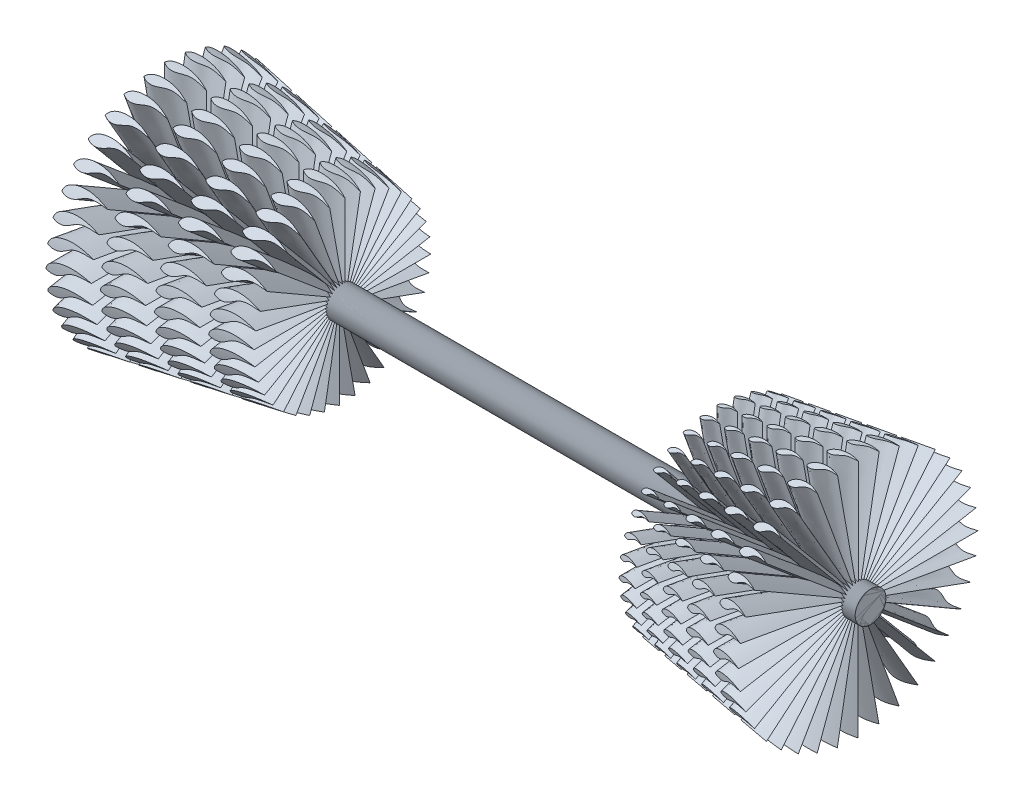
SolidWorks part; units mm, degrees
ref_plane "Front Plane" through (0, 0, 0) normal (0, 0, 1) x (1, 0, 0)
ref_plane "Top Plane" through (0, 0, 0) normal (0, 1, 0) x (1, 0, 0)
ref_plane "Right Plane" through (0, 0, 0) normal (1, 0, 0) x (0, 0, -1)
sketch "Sketch1" plane through (0, 0, 0) normal (0, 0, 1) x (1, 0, 0)
  line L0 (-8409.0038, 0) -> (412041.1874, 0) construction
  line L1 (-825.2751, 0) -> (-825.2751, -600.71) construction
  line L2 (-825.2751, -600.71) -> (-647.4751, -508) construction
  line L3 (-647.4751, -508) -> (1105.1249, -279.4) construction
  line L4 (1105.1249, -279.4) -> (2629.1249, -508) construction
  line L5 (2629.1249, -508) -> (3264.1249, -406.4) construction
  line L6 (3264.1249, -406.4) -> (3264.1249, 0) construction
  line L11 (-647.4751, -1000) -> (-647.4751, 49000) construction
  line L12 (-139.4751, -974.1318) -> (-139.4751, 49025.8682) construction
  line L13 (2451.3249, -1000) -> (2451.3249, 49000) construction
  line L14 (1816.3249, -978.7031) -> (1816.3249, 49021.2969) construction
  line L15 (-418.8751, -909.4028) -> (-418.8751, 49090.5972) construction
  line L17 (-291.8751, 0) -> (-291.8751, -63.5)
  line L18 (-291.8751, -63.5) -> (2451.3249, -63.5)
  line L19 (-291.8751, 0) -> (2451.3249, 0)
  line L20 (2552.9249, -1117.9768) -> (2552.9249, 48882.0232) construction
  line L21 (2451.3249, 0) -> (2552.9249, 0)
  line L23 (2552.9249, -63.5) -> (2451.3249, -63.5)
  line L24 (2552.9249, 0) -> (2679.8259, 0)
  line L25 (2679.8259, 0) -> (2679.8259, -63.5)
  line L26 (2679.8259, -63.5) -> (2552.9249, -63.5)
  dimension "D1" = 600.71
  dimension "D2" = 177.8
  dimension "D3" = 1752.6
  dimension "D4" = 1524
  dimension "D5" = 279.4
  dimension "D6" = 508
  dimension "D7" = 508
  dimension "D8" = 406.4
  dimension "D9" = 4089.4
  dimension "D10" = 2743.2
  dimension "D11" = 63.5
  dimension "D12" = 177.8
  dimension "D13" = 508
  dimension "D14" = 635
  dimension "D15" = 406.4
  dimension "D16" = 63.5
  dimension "D17" = 101.6
revolve "Revolve1" add sketch "Sketch1" angle 360 about L0
ref_plane "Plane1" through (0, -508, 0) normal (0, 1, 0) x (1, 0, 0)
sketch "Sketch2" plane through (0, -508, 0) normal (0, 1, 0) x (1, 0, 0)
  line L0 (2292.8763, -990.2749) -> (2292.8763, 49009.7251) construction
  line L1 (2490.4831, -1000) -> (2490.4831, 49000) construction
  line L2 (2679.8259, -63.5) -> (2679.8259, 63.5) construction
  line L3 (-647.4751, -1000) -> (-647.4751, 49000) construction
  line L4 (-247.4251, -889.7746) -> (-247.4251, 49110.2254) construction
  line L5 (-1247.4251, 0) -> (48752.5749, 0) construction
  dimension "D1" = 400.05
  dimension "D2" = 197.6068
  dimension "D3" = 50.8
sketch_block_instance "Block3-1"
sketch_block "Block3"
sketch_block_instance "Block1-12"
sketch_block "Block1" parameters "D1"=70.2962
sketch_block_instance "Block1-13"
sketch_block_instance "Block1-14"
sketch_block_instance "Block1-10"
sketch_block_instance "Block1-11"
extrude "Boss-Extrude1" add sketch "Sketch2" along normal blind 508 separate body
ref_plane "Plane3" through (0, -508, 0) normal (0, 1, 0) x (1, 0, 0)
sketch "Sketch5" plane through (0, -508, 0) normal (0, 1, 0) x (1, 0, 0)
  spline S6 degree 5 poles (-226.8427, 1.5804) (-193.1535, 25.7283) (-153.5018, 5.9372) (-160.1199, -24.3536) (-124.8514, -19.6639) (-67.5578, -11.2906) knots 0 0 0 0 0 0 1 1 1 1 1 1
  spline S7 degree 4 poles (-226.8427, 1.5804) (-224.2251, -46.2622) (-138.3087, -41.2596) (-114.5636, -30.988) (-67.5578, -11.2906) knots 0 0 0 0 0 1 1 1 1 1
  dimension "D1" = 159.2849
extrude "Boss-Extrude2" add sketch "Sketch5" along normal blind 508
pattern_linear "LPattern1" count 4 spacing 190.5 along (1, 0, 0) of "Boss-Extrude2"
ref_plane "Plane2" through (0, 0, 0) normal (0, 0, 1) x (1, 0, 0)
pattern_circular "CirPattern1" count 36 over 360 about axis through (-8409.0038, 0, 0) along (1, 0, 0) of "Boss-Extrude2"
sketch "Sketch4" plane through (-291.8751, 0, 0) normal (-1, 0, 0) x (0, 0, 1)
  circle A0 centre (0, 0) radius 63.5
sketch "Sketch3" plane through (0, 0, 0) normal (0, 0, 1) x (1, 0, 0)
  line L3 (-1000, 0) -> (49000, 0) construction
  line L4 (-329.9751, 0) -> (-329.9751, -600.71) construction
  line L5 (-329.9751, -600.71) -> (-253.7751, -508) construction
  line L6 (-253.7751, -508) -> (1067.0249, -279.4) construction
  line L7 (1067.0249, -279.4) -> (2641.8249, -508) construction
  line L8 (2641.8249, -508) -> (3022.8249, -254) construction
  line L9 (3022.8249, -254) -> (3022.8249, 0) construction
  line L10 (-406.1751, -968.0454) -> (-406.1751, 49031.9546) construction
  line L11 (1066.8498, -266.5415) -> (3875.2185, -674.2079)
  line L12 (-1204.2907, -659.6235) -> (1066.8498, -266.5415)
  line L13 (-1204.2907, -659.6235) -> (3875.2185, -674.2079)
  line L14 (-291.8751, 63.5) -> (-291.8751, -63.5) construction
  dimension "D1" = 600.71
  dimension "D2" = 76.2
  dimension "D3" = 508
  dimension "D4" = 1320.8
  dimension "D5" = 1574.8
  dimension "D6" = 279.4
  dimension "D7" = 508
  dimension "D8" = 381
  dimension "D9" = 254
  dimension "D10" = 76.2
  dimension "D11" = 25.4
  dimension "D12" = 25.4
  dimension "D13" = 38.1
revolve "Cut-Revolve1" cut sketch "Sketch3" angle 360 about L3
